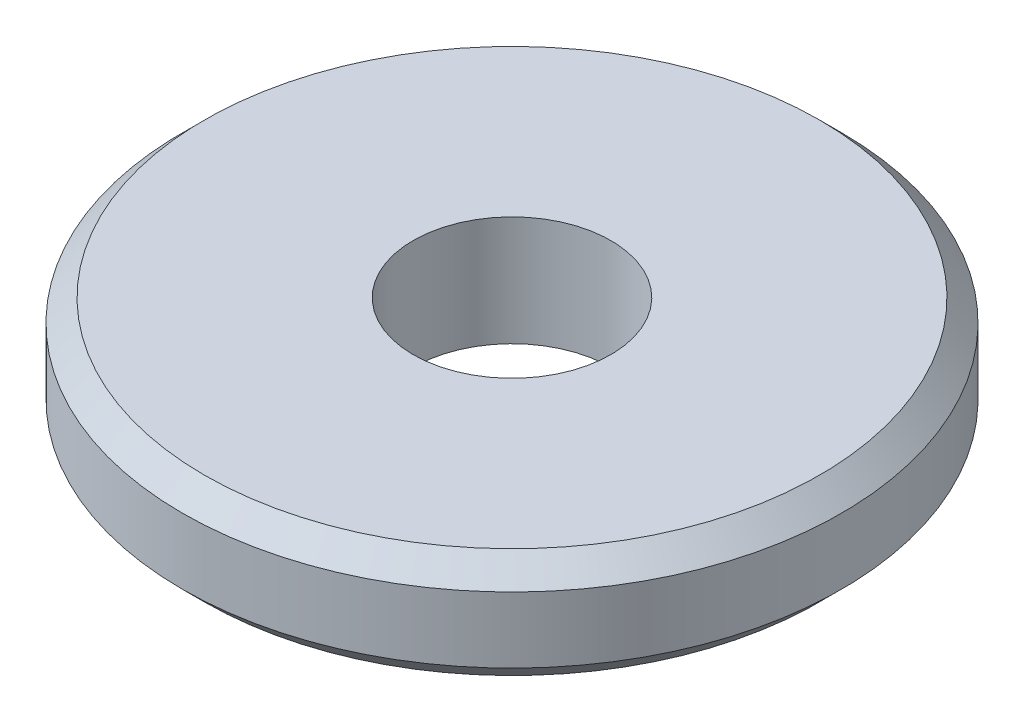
SolidWorks part; units mm, degrees
ref_plane "Front Plane" through (0, 0, 0) normal (0, 0, 1) x (1, 0, 0)
ref_plane "Top Plane" through (0, 0, 0) normal (0, 1, 0) x (1, 0, 0)
ref_plane "Right Plane" through (0, 0, 0) normal (1, 0, 0) x (0, 0, -1)
sketch "Sketch1" plane through (0, 0, 0) normal (0, 1, 0) x (1, 0, 0)
  circle A0 centre (0, 0) radius 15
  circle A1 centre (0, 0) radius 4.5
  dimension "D1" = 9
  dimension "D2" = 30
extrude "Extrude1" add sketch "Sketch1" along normal blind 5
chamfer "Chamfer1" distance 1 angle 45 2 edges at (0, 0, 15) (0, 5, 15)
